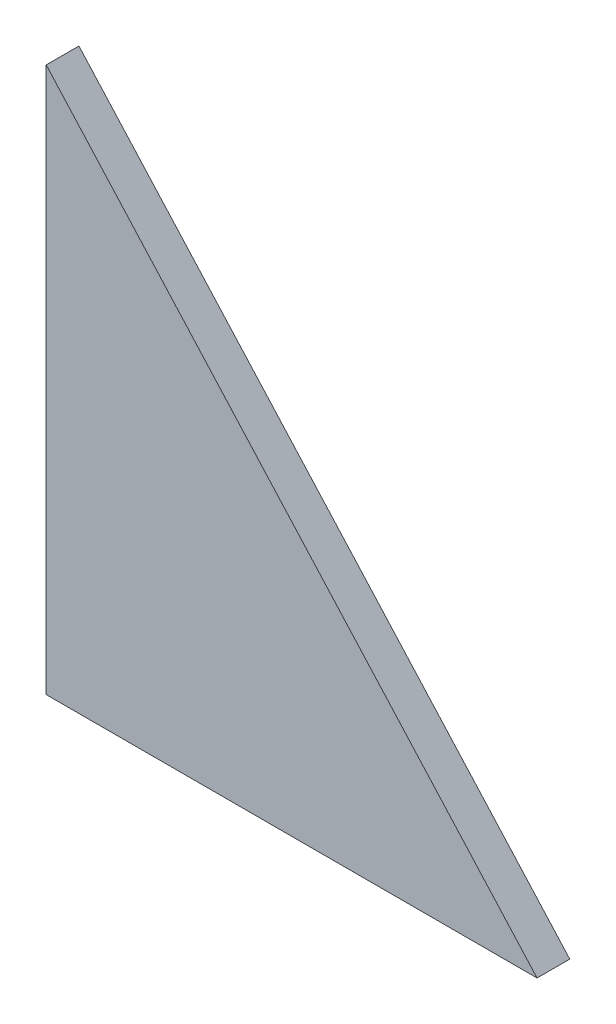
SolidWorks part; units mm, degrees
ref_plane "前视基准面" through (0, 0, 0) normal (0, 0, 1) x (1, 0, 0)
ref_plane "上视基准面" through (0, 0, 0) normal (0, 1, 0) x (1, 0, 0)
ref_plane "右视基准面" through (0, 0, 0) normal (1, 0, 0) x (0, 0, -1)
sketch "草图1" plane through (0, 0, 0) normal (0, 0, 1) x (1, 0, 0)
  line L0 (0, 100) -> (0, 0)
  line L1 (0, 0) -> (90, 0)
  line L2 (90, 0) -> (0, 100)
  dimension "D1" = 100
  dimension "D2" = 90
extrude "拉伸1" add sketch "草图1" along normal blind 6
